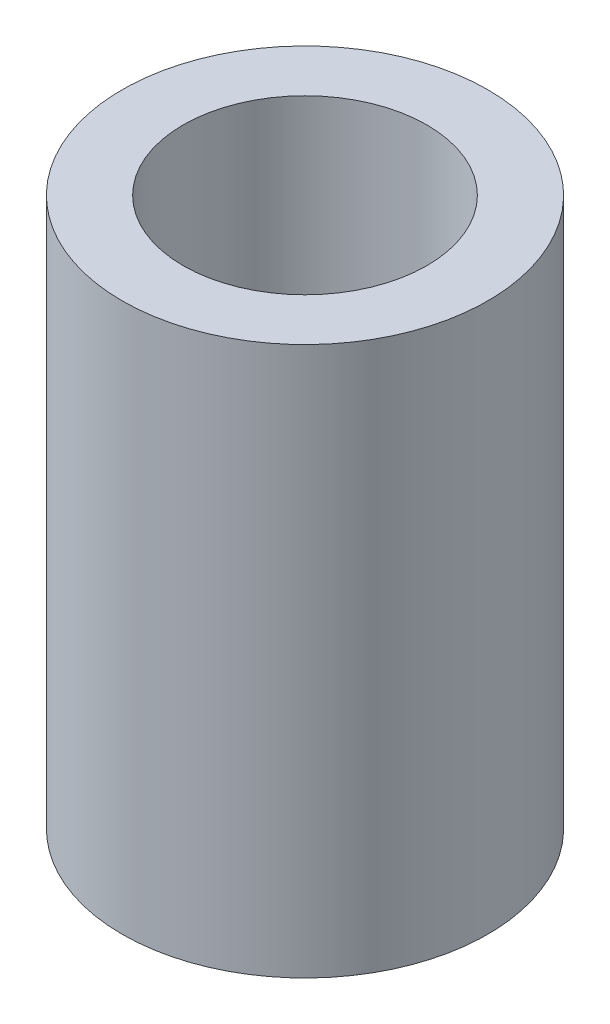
SolidWorks part; units mm, degrees
ref_plane "Front Plane" through (0, 0, 0) normal (0, 0, 1) x (1, 0, 0)
ref_plane "Top Plane" through (0, 0, 0) normal (0, 1, 0) x (1, 0, 0)
ref_plane "Right Plane" through (0, 0, 0) normal (1, 0, 0) x (0, 0, -1)
sketch "Sketch1" plane through (0, 0, 0) normal (0, 1, 0) x (1, 0, 0)
  circle A0 centre (0, 0) radius 1.5
  circle A1 centre (0, 0) radius 1
  dimension "D1" = 2
  dimension "D2" = 3
extrude "Boss-Extrude1" add sketch "Sketch1" along normal blind 4.5
sketch "Sketch2" plane through (0, 0, 0) normal (0, -1, 0) x (1, 0, 0)
  line L0 (0, 0) -> (1, 0) construction
  circle A0 centre (0, 0) radius 1 construction
